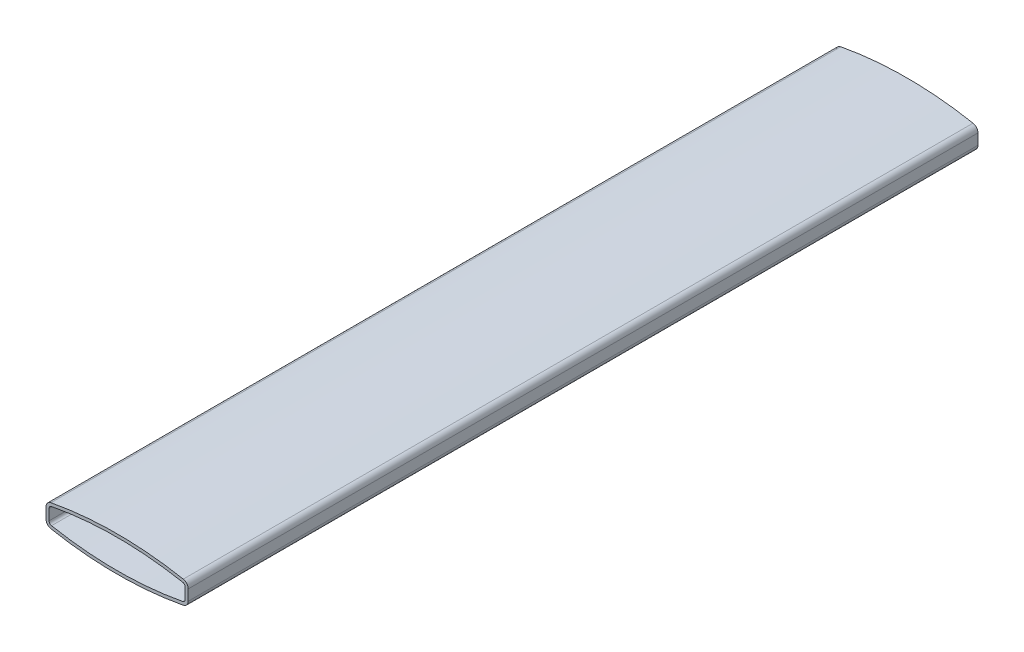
SolidWorks part; units mm, degrees
ref_plane "Front Plane" through (0, 0, 0) normal (0, 0, 1) x (1, 0, 0)
ref_plane "Top Plane" through (0, 0, 0) normal (0, 1, 0) x (1, 0, 0)
ref_plane "Right Plane" through (0, 0, 0) normal (1, 0, 0) x (0, 0, -1)
sketch "Sketch1" plane through (0, 0, 0) normal (0, 0, 1) x (1, 0, 0)
  line L0 (-26.375, 0) -> (26.375, 0) construction
  line L1 (-26.375, 8.625) -> (26.375, 8.625) construction
  line L2 (-26.375, -8.625) -> (26.375, -8.625) construction
  line L3 (-26.375, 7.125) -> (26.375, 7.125) construction
  line L4 (-26.375, -7.125) -> (26.375, -7.125) construction
  line L5 (-35, 0) -> (-35, -5.0893)
  line L6 (35, 0) -> (35, 5.0893)
  line L7 (-35, 0) -> (-35, 5.0893)
  line L8 (35, 0) -> (35, -5.0893)
  arc A0 (-26.375, 8.625) -> (-26.375, -8.625) centre (-26.375, 0) ccw construction
  arc A1 (26.375, -8.625) -> (26.375, 8.625) centre (26.375, 0) ccw construction
  arc A2 (26.375, -7.125) -> (26.375, 7.125) centre (26.375, 0) ccw construction
  arc A3 (-26.375, 7.125) -> (-26.375, -7.125) centre (-26.375, 0) ccw construction
  arc A4 (35, 5.0893) -> (-35, 5.0893) centre (0, -166.375) ccw
  arc A5 (-35, -5.0893) -> (35, -5.0893) centre (0, 166.375) ccw
  point P2 (0, 0)
  dimension "D2" = 70
  dimension "D4" = 350
  dimension "D1" = 17.25
  dimension "D3" = 1.5
extrude "Boss-Extrude1" add sketch "Sketch1" along normal blind 388.65
fillet "Fillet1" radius 3 4 edges at (35, -5.0893, 194.325) (35, 5.0893, 194.325) (-35, -5.0893, 194.325) (-35, 5.0893, 194.325)
shell "Shell1" thickness 1.5
